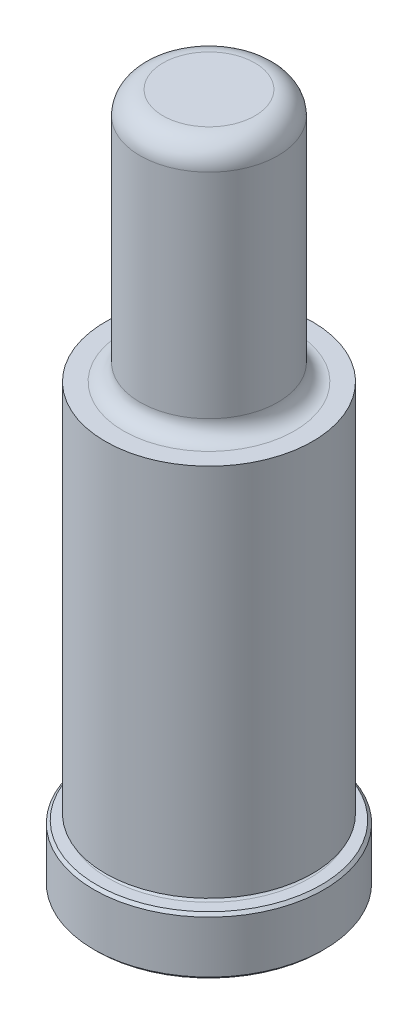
SolidWorks part; units mm, degrees
ref_plane "Front Plane" through (0, 0, 0) normal (0, 0, 1) x (1, 0, 0)
ref_plane "Top Plane" through (0, 0, 0) normal (0, 1, 0) x (1, 0, 0)
ref_plane "Right Plane" through (0, 0, 0) normal (1, 0, 0) x (0, 0, -1)
sketch "Sketch1" plane through (0, 0, 0) normal (1, 0, 0) x (0, 0, -1)
  line L0 (0, 0) -> (15.875, 0)
  line L1 (15.875, 0) -> (15.875, 7.9248)
  line L2 (15.875, 7.9248) -> (13.8938, 7.9248)
  line L3 (13.5128, 2.6782) -> (13.5128, 5.9795) construction
  line L4 (13.8938, 8.6868) -> (14.3002, 8.6868)
  line L5 (14.3002, 8.6868) -> (14.3002, 60.325)
  line L6 (14.3002, 60.325) -> (11.7983, 60.325)
  line L7 (9.5123, 62.611) -> (9.5123, 95.25)
  line L9 (9.5123, 95.25) -> (0, 95.25)
  line L10 (0, 95.25) -> (0, 0)
  line L11 (0, 0) -> (0, -7.2694) construction
  arc A0 (13.8938, 8.6868) -> (13.8938, 7.9248) centre (13.8938, 8.3058) ccw
  arc A1 (11.7983, 60.325) -> (9.5123, 62.611) centre (11.7983, 62.611) cw
  point P19 (9.5123, 60.325)
  dimension "D14" = 0.762
  dimension "D8" = 2.286
  dimension "T" = 7.9248
  dimension "D2" = 0.762
  dimension "M" = 31.75
  dimension "B" = 28.6004
  dimension "L" = 95.25
  dimension "D7" = 0.7874
  dimension "A" = 60.325
  dimension "D" = 19.0246
  dimension "D15" = 34.925
revolve "Revolve1" add sketch "Sketch1" angle 360 about L11
chamfer "Chamfer1" distance 0.381 angle 45 2 edges at (0, 0, 15.875) (0, 7.9248, 15.875)
fillet "Fillet1" radius 3.175 1 edges at (0, 95.25, 9.5123)
